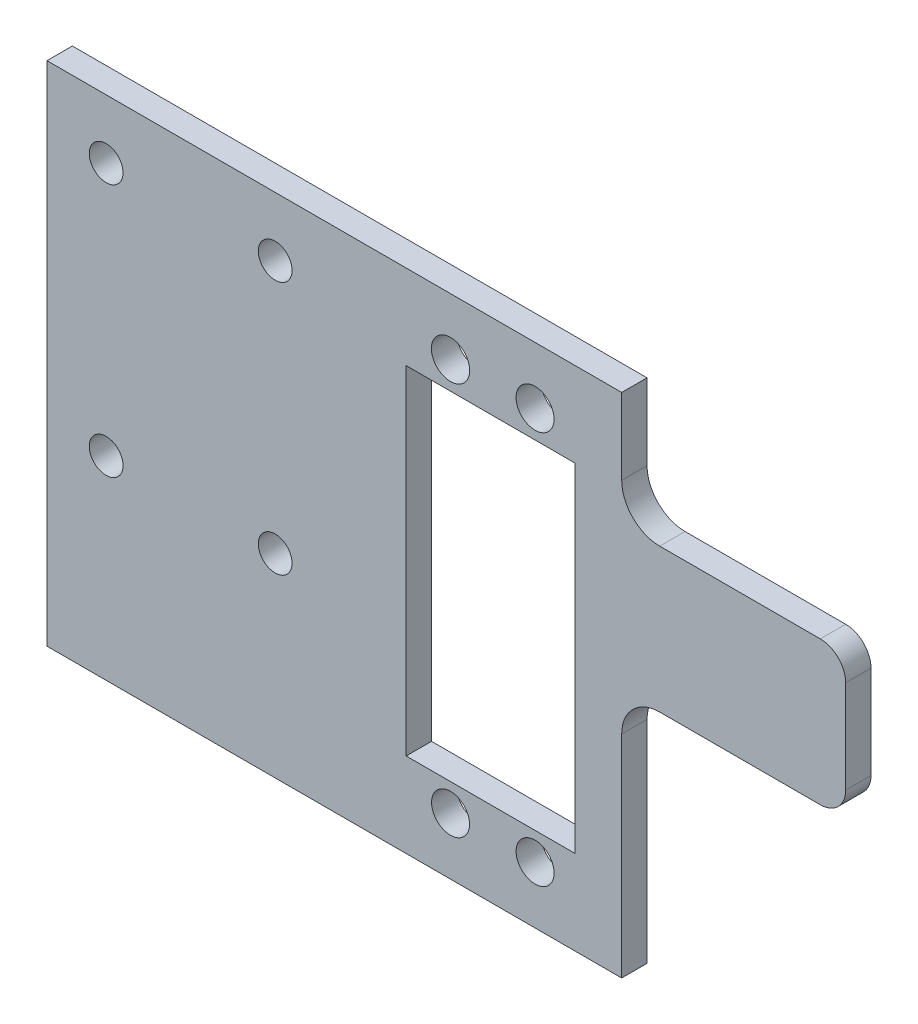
SolidWorks part; units mm, degrees
ref_plane "Front Plane" through (0, 0, 0) normal (0, 0, 1) x (1, 0, 0)
ref_plane "Top Plane" through (0, 0, 0) normal (0, 1, 0) x (1, 0, 0)
ref_plane "Right Plane" through (0, 0, 0) normal (1, 0, 0) x (0, 0, -1)
sketch "Sketch2" plane through (0, 0, 0) normal (0, 0, 1) x (1, 0, 0)
  line L0 (-85.9389, 45.7205) -> (-83.9389, 45.7205)
  line L1 (-85.9389, 45.7205) -> (-20.9389, 45.7205)
  line L2 (-85.9389, 45.7205) -> (-85.9389, -14.2795)
  line L3 (-85.9389, -14.2795) -> (-20.9389, -14.2795)
  line L4 (-20.9389, -14.2795) -> (-17.9389, -14.2795)
  line L5 (-83.9389, 45.7205) -> (-83.9389, 43.7205)
  line L6 (-33.4389, 35.7205) -> (-23.4389, 35.7205)
  line L7 (-20.9389, 45.7205) -> (-17.9389, 45.7205)
  line L8 (-17.9389, 45.7205) -> (-17.9389, 36.7205)
  line L9 (-17.9389, -14.2795) -> (-18.2277, -14.4769)
  line L10 (-17.9389, 10.7205) -> (-17.9389, -14.2795)
  line L11 (8.5611, 23.7205) -> (8.5611, 29.2205)
  line L13 (8.5611, 23.7205) -> (8.5611, 18.2205)
  line L16 (-33.4389, 35.7205) -> (-43.4389, 35.7205)
  line L17 (-43.4389, 35.7205) -> (-43.4389, -4.2795)
  line L18 (-43.4389, -4.2795) -> (-23.4389, -4.2795)
  line L19 (-23.4389, -4.2795) -> (-23.4389, 35.7205)
  line L22 (5.5611, 15.2205) -> (-13.4389, 15.2205)
  line L23 (5.5611, 32.2205) -> (-13.4389, 32.2205)
  circle A0 centre (-78.9389, 38.7205) radius 2
  circle A1 centre (-78.9389, 8.7205) radius 2
  circle A2 centre (-58.9389, 38.7205) radius 2
  circle A3 centre (-58.9389, 8.7205) radius 2
  arc A4 (8.5611, 18.2205) -> (5.5611, 15.2205) centre (5.5611, 18.2205) cw
  arc A5 (8.5611, 29.2205) -> (5.5611, 32.2205) centre (5.5611, 29.2205) ccw
  arc A6 (-13.4389, 15.2205) -> (-17.9389, 10.7205) centre (-13.4389, 10.7205) ccw
  arc A7 (-13.4389, 32.2205) -> (-17.9389, 36.7205) centre (-13.4389, 36.7205) cw
  circle A8 centre (-28.1889, 38.9705) radius 2.25
  circle A9 centre (-38.1889, 38.9705) radius 2.2638
  circle A10 centre (-28.1889, -7.5295) radius 2.25
  circle A11 centre (-38.1889, -7.5295) radius 2.25
  point P8 (0, 0)
  point P39 (-17.9389, 32.2205)
  dimension "D3" = 3
  dimension "D5" = 3
  dimension "D6" = 4.5
  dimension "D9" = 4
  dimension "D1" = 65
  dimension "D2" = 60
  dimension "D4" = 23.5
  dimension "D7" = 40
  dimension "D8" = 20
extrude "Boss-Extrude1" add sketch "Sketch2" along normal blind 3
